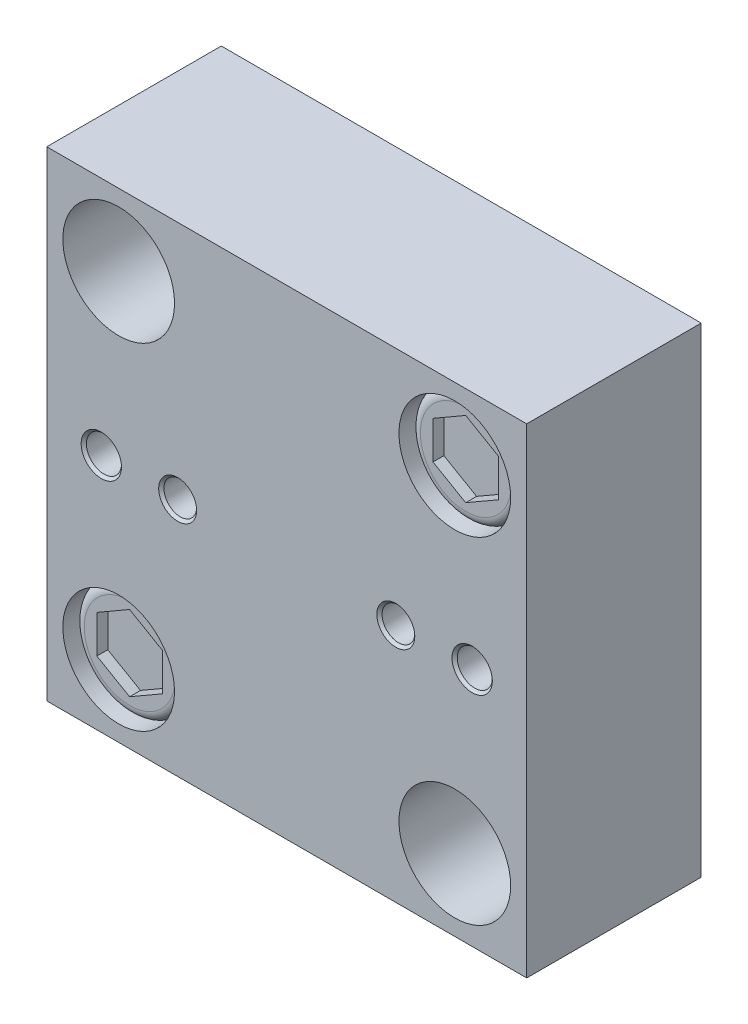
SolidWorks part; units mm, degrees
ref_plane "Front Plane" through (0, 0, 0) normal (0, 0, 1) x (1, 0, 0)
ref_plane "Top Plane" through (0, 0, 0) normal (0, 1, 0) x (1, 0, 0)
ref_plane "Right Plane" through (0, 0, 0) normal (1, 0, 0) x (0, 0, -1)
sketch "Sketch1" plane through (0, 0, 0) normal (0, 0, 1) x (1, 0, 0)
  line L0 (-34.925, 34.925) -> (34.925, -34.925) construction
  line L1 (-34.925, 34.925) -> (34.925, 34.925)
  line L2 (-34.925, 34.925) -> (-34.925, -34.925)
  line L3 (-34.925, -34.925) -> (34.925, -34.925)
  line L4 (34.925, 34.925) -> (34.925, -34.925)
  dimension "D1" = 69.85
  dimension "D2" = 69.85
extrude "Extrude1" add sketch "Sketch1" along normal blind 25.4
sketch "Sketch2" plane through (0, 0, 25.4) normal (0, 0, 1) x (1, 0, 0)
  line L0 (-24.4602, 24.4602) -> (24.4602, -24.4602) construction
  circle A0 centre (-24.4602, 24.4602) radius 8.128
  circle A1 centre (24.4602, 24.4602) radius 8.128
  circle A2 centre (-24.4602, -24.4602) radius 8.128
  circle A3 centre (24.4602, -24.4602) radius 8.128
  dimension "D1" = 16.256
  dimension "D2" = 48.9204
  dimension "D3" = 48.9204
extrude "Cut-Extrude1" cut sketch "Sketch2" against normal through all
hole_wizard "Hole1" positions "Sketch4" profile "Sketch3" legacy
sketch "Sketch4" plane through (0, 0, 0) normal (0, 0, -1) x (-1, 0, 0)
  line L0 (-15.875, 0) -> (15.875, 0) construction
  point P0 (-15.875, 0)
  point P2 (15.875, 0)
  dimension "D1" = 31.75
sketch "Sketch3" plane through (15.875, 0, 0) normal (1, 0, 0) x (0, 1, 0)
  line L0 (0, 0) -> (0, 25.4)
  line L1 (0, 25.4) -> (2.3813, 25.4)
  line L2 (2.3813, 25.4) -> (2.3813, 12.7)
  line L3 (2.3813, 12.7) -> (2.9845, 12.7)
  line L4 (2.9845, 12.7) -> (2.9845, 0)
  line L5 (2.9845, 0) -> (0, 0)
  line L6 (0, 110) -> (0, -10) construction
  dimension "Diameter" = 4.7625
  dimension "Depth" = 25.4
  dimension "C-Bore Diameter" = 5.969
  dimension "C-Bore Depth" = 12.7
hole_wizard "1/4-20 Tapped Hole1" positions "Sketch6" profile "Sketch5" tap size "1/4-20" standard "ANSI Inch"
sketch "Sketch6" plane through (0, 0, 25.4) normal (0, 0, 1) x (1, 0, 0)
  line L0 (-26.9875, 0) -> (26.9875, 0) construction
  point P4 (-26.9875, 0)
  point P6 (26.9875, 0)
  dimension "D1" = 53.975
sketch "Sketch5" plane through (-26.9875, 0, 25.4) normal (1, 0, 0) x (0, -1, 0)
  line L0 (0, 0) -> (0, 25.4)
  line L1 (0, 25.4) -> (2.5527, 25.4)
  line L2 (2.5527, 25.4) -> (2.5527, 0)
  line L5 (2.5527, 0) -> (0, 0)
  line L11 (0, -6.35) -> (0, 107.95) construction
  dimension "Thru Tap Drill Dia." = 5.1054
  dimension "Thru Tap Drill Depth" = 25.4
sketch "Sketch7" plane through (0, 0, 0) normal (0, 0, -1) x (-1, 0, 0)
  circle A4 centre (-24.4602, 24.4602) radius 8.128 construction
  circle A5 centre (-24.4602, 24.4602) radius 8.128
  circle A6 centre (24.4602, -24.4602) radius 8.128 construction
  circle A7 centre (24.4602, -24.4602) radius 8.128
extrude "Boss-Extrude1" add sketch "Sketch7" against normal offset from surface (23.8125 mm away) 1.5875 separate body
fillet "Fillet1" radius 1.524 1 edges at (32.5882, 24.4602, 23.8125)
fillet "Fillet2" radius 1.524 1 edges at (-16.3322, -24.4602, 23.8125)
sketch "Sketch8" plane through (0, 0, 23.8125) normal (0, 0, 1) x (1, 0, 0)
  line L1 (24.4602, 29.9595) -> (19.6977, 27.2098)
  line L2 (19.6977, 27.2098) -> (19.6977, 21.7106)
  line L3 (19.6977, 21.7106) -> (24.4602, 18.9609)
  line L4 (24.4602, 18.9609) -> (29.2227, 21.7106)
  line L5 (29.2227, 21.7106) -> (29.2227, 27.2098)
  line L6 (29.2227, 27.2098) -> (24.4602, 29.9595)
  line L7 (-24.4602, -18.9609) -> (-29.2227, -21.7106)
  line L8 (-29.2227, -21.7106) -> (-29.2227, -27.2098)
  line L9 (-29.2227, -27.2098) -> (-24.4602, -29.9595)
  line L10 (-24.4602, -29.9595) -> (-19.6977, -27.2098)
  line L11 (-19.6977, -27.2098) -> (-19.6977, -21.7106)
  line L12 (-19.6977, -21.7106) -> (-24.4602, -18.9609)
  circle A0 centre (24.4602, 24.4602) radius 4.7625 construction
  circle A1 centre (-24.4602, -24.4602) radius 4.7625 construction
  circle A2 centre (24.4602, 24.4602) radius 6.604 construction
  circle A3 centre (-24.4602, -24.4602) radius 6.604 construction
  dimension "D1" = 9.525
extrude "Cut-Extrude2" cut sketch "Sketch8" against normal blind 1.5875
chamfer "Chamfer1" distance 0.381 angle 45 4 edges at (29.5402, 0, 25.4) (-18.2563, 0, 25.4) (-24.4348, 0, 25.4) (13.4937, 0, 25.4)
